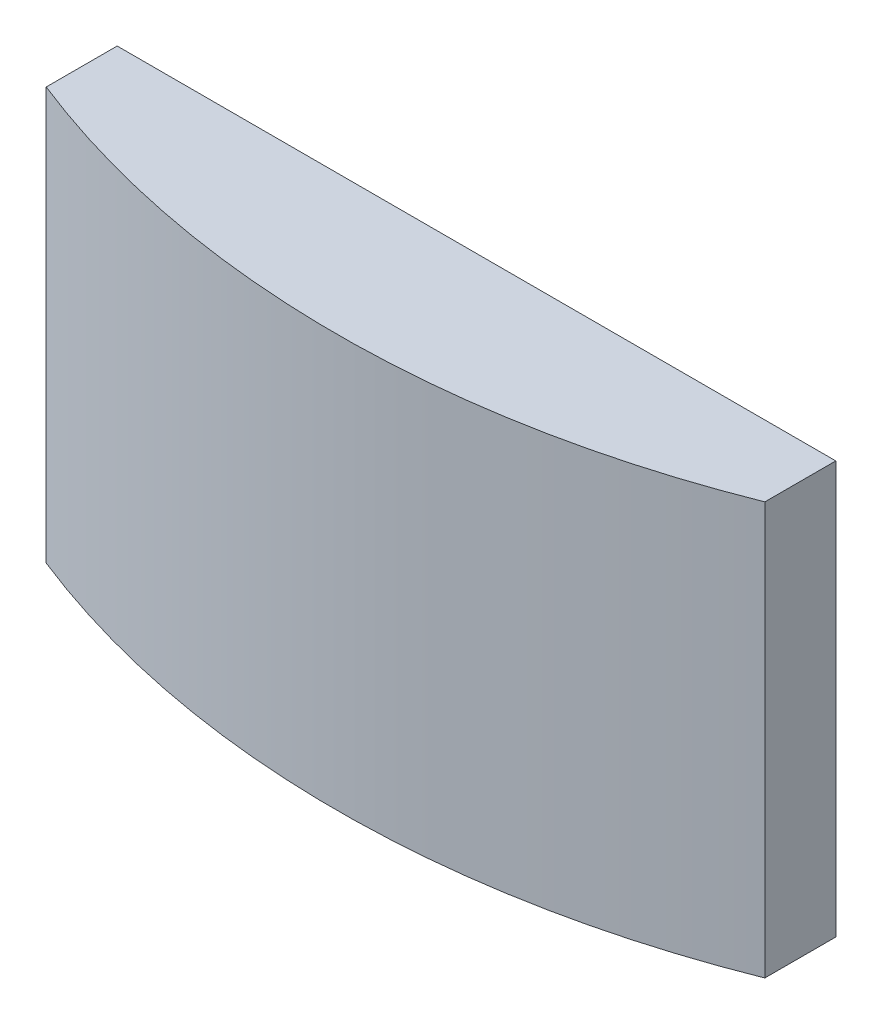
SolidWorks part; units mm, degrees
ref_plane "Front" through (0, 0, 0) normal (0, 0, 1) x (1, 0, 0)
ref_plane "Top" through (0, 0, 0) normal (0, 1, 0) x (1, 0, 0)
ref_plane "Right" through (0, 0, 0) normal (1, 0, 0) x (0, 0, -1)
sketch "Sketch2" plane through (0, 0, 0) normal (0, 1, 0) x (1, 0, 0)
  line L0 (-59.3912, 0) -> (-59.3912, 11.9529)
  line L1 (-59.3912, 11.9529) -> (61.6324, 11.9529)
  line L2 (61.6324, 11.9529) -> (61.6324, 0)
  arc A0 (-59.3912, 0) -> (61.6324, 0) centre (1.1206, 152.2675) ccw
extrude "Extrude2" add sketch "Sketch2" along normal blind 69.4428
ref_plane "Plane1" through (0, 0, -82.3326) normal (0, 0, 1) x (1, 0, 0)
sketch "Sketch3" plane through (0, 0, -82.3326) normal (0, 0, 1) x (1, 0, 0)
  line L1 (22.5924, 8.76) -> (22.5924, 29.9103)
  line L2 (22.5924, 29.9103) -> (49.511, 29.9103)
  line L3 (49.511, 29.9103) -> (49.511, 62.3569)
  line L4 (49.511, 62.3569) -> (-25.9572, 62.3569)
  line L5 (-25.9572, 62.3569) -> (-25.9572, 38.8031)
  line L6 (-25.9572, 38.8031) -> (-50.7127, 38.8031)
  line L7 (-50.7127, 38.8031) -> (-50.7127, 8.76)
  line L8 (-50.7127, 8.76) -> (22.5924, 8.76)
